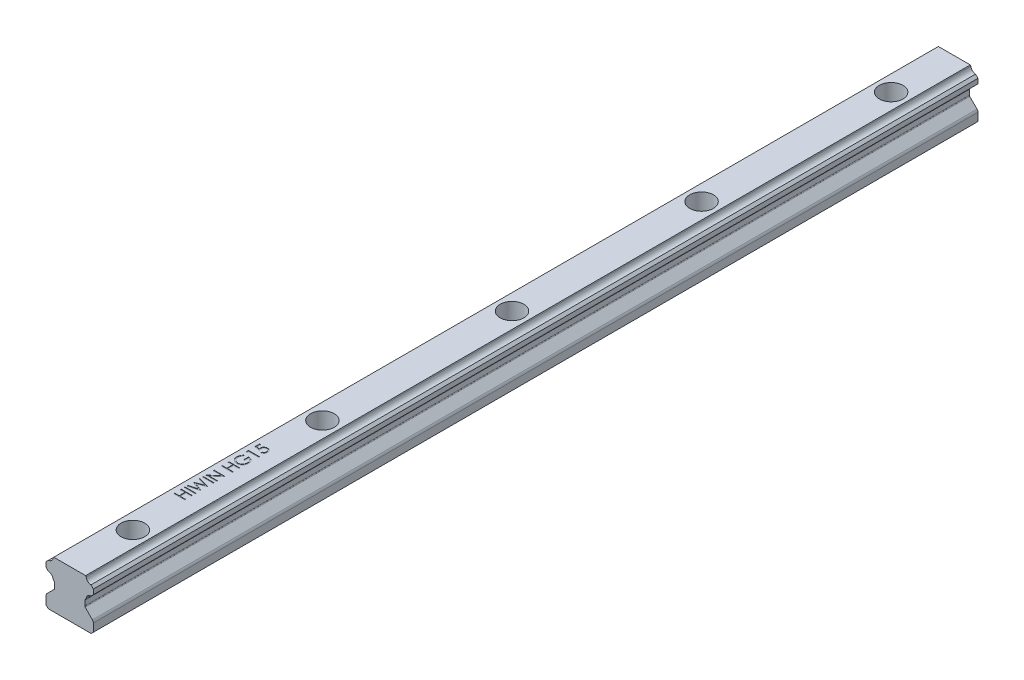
SolidWorks part; units mm, degrees
ref_plane "前视基准面" through (0, 0, 0) normal (0, 0, 1) x (1, 0, 0)
ref_plane "上视基准面" through (0, 0, 0) normal (0, 1, 0) x (1, 0, 0)
ref_plane "右视基准面" through (0, 0, 0) normal (1, 0, 0) x (0, 0, -1)
sketch "草图1" plane through (0, 0, 0) normal (0, 0, 1) x (1, 0, 0)
  line L20 (7.5, 12.549) -> (6.7304, 13.3186)
  line L21 (-5.049, 15) -> (-5.1049, 14.9441)
  line L22 (-7.5, 12.549) -> (-7.5, 11.011)
  line L23 (6.7419, 10.2529) -> (7.5, 11.011)
  line L24 (-6.7304, 13.3186) -> (-7.5, 12.549)
  line L25 (-4.8872, 6.2704) -> (-7.2071, 3.9505)
  line L26 (-7.5, 0.7) -> (-6.8, 0)
  line L27 (7.2071, 3.9505) -> (4.8872, 6.2704)
  line L28 (-4.77, 8.1153) -> (-4.77, 6.5533)
  line L29 (7.5, 0.7) -> (7.5, 3.2434)
  line L30 (6.8, 0) -> (7.5, 0.7)
  line L31 (-6.8, 0) -> (6.8, 0)
  line L32 (-7.5, 3.2434) -> (-7.5, 0.7)
  line L33 (4.77, 6.5533) -> (4.77, 8.1153)
  line L34 (-5.1032, 8.6142) -> (-4.8872, 8.3982)
  line L35 (5.049, 15) -> (-5.049, 15)
  line L36 (5.1049, 14.9441) -> (5.049, 15)
  line L37 (7.5, 11.011) -> (7.5, 12.549)
  line L38 (4.8872, 8.3982) -> (5.1032, 8.6142)
  line L39 (-7.5, 11.011) -> (-6.7419, 10.2529)
  arc A14 (-5.217, 8.8451) -> (-5.1032, 8.6142) centre (-4.8204, 8.897) ccw
  arc A15 (5.1032, 8.6142) -> (5.217, 8.8451) centre (4.8204, 8.897) ccw
  arc A16 (-5.217, 8.8451) -> (-6.7419, 10.2529) centre (-6.8233, 8.6349) ccw
  arc A17 (-7.2071, 3.9505) -> (-7.5, 3.2434) centre (-6.5, 3.2434) ccw
  arc A18 (4.77, 6.5533) -> (4.8872, 6.2704) centre (5.17, 6.5533) ccw
  arc A19 (-5.1049, 14.9441) -> (-5.2183, 14.7157) centre (-4.822, 14.6613) ccw
  arc A20 (4.8872, 8.3982) -> (4.77, 8.1153) centre (5.17, 8.1153) ccw
  arc A21 (5.2183, 14.7157) -> (5.1049, 14.9441) centre (4.822, 14.6613) ccw
  arc A22 (-6.7304, 13.3186) -> (-5.2183, 14.7157) centre (-6.8233, 14.936) ccw
  arc A23 (6.7419, 10.2529) -> (5.217, 8.8451) centre (6.8233, 8.6349) ccw
  arc A24 (5.2183, 14.7157) -> (6.7304, 13.3186) centre (6.8233, 14.936) ccw
  arc A25 (7.5, 3.2434) -> (7.2071, 3.9505) centre (6.5, 3.2434) ccw
  arc A26 (-4.8872, 6.2704) -> (-4.77, 6.5533) centre (-5.17, 6.5533) ccw
  arc A27 (-4.77, 8.1153) -> (-4.8872, 8.3982) centre (-5.17, 8.1153) ccw
extrude "凸台-拉伸1" add sketch "草图1" against normal blind 280
hole_wizard "M4 六角凹头螺钉的柱形沉头孔1" positions "草图3" profile "草图2" counterbore size "M4" standard "ISO"
sketch "草图3" plane through (0.2915, 15, -3.4663) normal (0, 1, 0) x (-1, 0, 0)
  point P0 (0.2915, -16.5337)
  dimension "D1" = 20
sketch "草图2" plane through (0, 15, -20) normal (1, 0, 0) x (0, 0, 1)
  line L0 (0, 0) -> (0, 15)
  line L1 (0, 15) -> (2.25, 15)
  line L3 (2.25, 15) -> (2.25, 5.3)
  line L4 (2.25, 5.3) -> (3.75, 5.3)
  line L5 (3.75, 5.3) -> (3.75, 0)
  line L7 (3.75, 0) -> (0, 0)
  line L11 (0, -6.35) -> (0, 107.95) construction
  dimension "通孔孔直径" = 4.5
  dimension "通孔孔深度" = 15
  dimension "柱形沉头孔直径" = 7.5
  dimension "柱形沉头孔深度" = 5.3
pattern_linear "阵列(线性)1" count 5 spacing 60 along (0, 0, -1) of "M4 六角凹头螺钉的柱形沉头孔1"
sketch "草图6" plane through (0, 15, 0) normal (0, 1, 0) x (1, 0, 0)
  line L0 (0, 20) -> (0, 80) construction
  text T0 "HIWIN HG15"
extrude "切除-拉伸1" cut sketch "草图6" against normal blind 0.1
equation "\"D1@凸台-拉伸1\" = 2 * \"D1@草图3\" + \"D3@阵列(线性)1\" *  ( \"D1@阵列(线性)1\"  - 1) "
